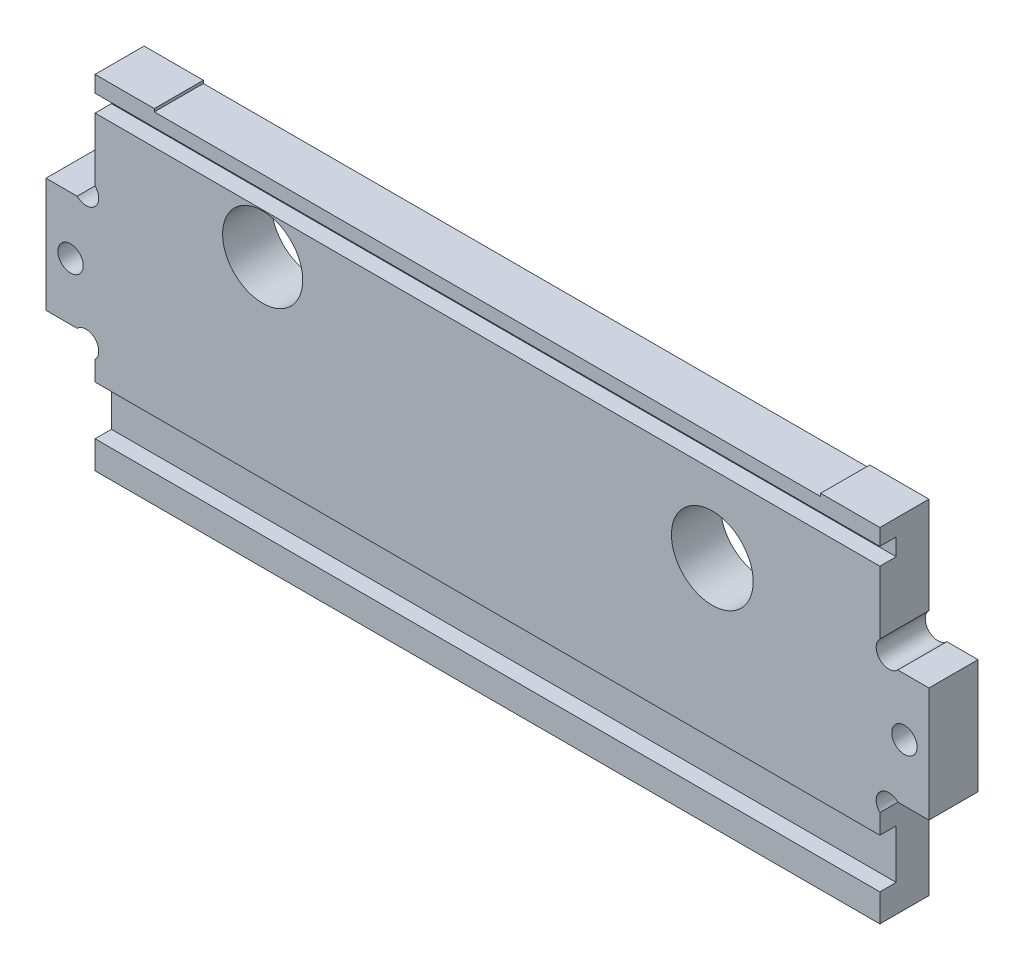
SolidWorks part; units mm, degrees
ref_plane "Plan de face" through (0, 0, 0) normal (0, 0, 1) x (1, 0, 0)
ref_plane "Plan de dessus" through (0, 0, 0) normal (0, 1, 0) x (1, 0, 0)
ref_plane "Plan de droite" through (0, 0, 0) normal (1, 0, 0) x (0, 0, -1)
sketch "Esquisse1" plane through (0, 0, 0) normal (0, 0, 1) x (1, 0, 0)
  line L0 (-18.4854, 0) -> (134.3664, 0) construction
  line L1 (0, -14.575) -> (0, 70.5052) construction
  line L2 (-18.4854, 42) -> (134.3664, 42) construction
  line L3 (-49.4967, 21) -> (232.5709, 21) construction
  line L4 (6, 65.2215) -> (6, -6.5783) construction
  line L5 (-6.1176, 9.4) -> (126.4146, 9.4) construction
  line L6 (-6.1176, 3.4) -> (126.4146, 3.4) construction
  line L7 (101.5, 56.6286) -> (101.5, -12.2812) construction
  line L8 (-7.2936, 37.9) -> (126.4146, 37.9) construction
  line L9 (-7.2936, 40) -> (126.4146, 40) construction
  line L10 (102, 56.6286) -> (102, -3.0419) construction
  line L11 (108, 70.5052) -> (108, -14.575) construction
  line L12 (54, 61.2759) -> (54, -18.1878) construction
  line L13 (6.2304, 24.4) -> (134.3664, 24.4) construction
  line L14 (6, 42) -> (13.25, 42)
  line L15 (6.5, 15.8677) -> (6.5, 70.5052) construction
  line L16 (-5.5754, 14) -> (7.661, 14) construction
  line L17 (6, 0) -> (102, 0)
  line L18 (6, 28) -> (-0.5822, 34.5822) construction
  line L19 (26.5, 37.2831) -> (26.5, 18.1829) construction
  line L20 (70.8365, 28.5) -> (98.2989, 28.5) construction
  line L21 (6, 42) -> (6, 30.192)
  line L22 (3.808, 28) -> (0, 28)
  line L23 (0, 28) -> (0, 14)
  line L24 (0, 14) -> (3.808, 14)
  line L25 (6, 11.808) -> (6, 0)
  line L26 (3, 24.9685) -> (3, 16.3645) construction
  line L27 (102, 11.808) -> (102, 0)
  line L28 (-9.5964, 28) -> (7.661, 28) construction
  line L29 (108, 14) -> (104.192, 14)
  line L30 (108, 28) -> (108, 14)
  line L31 (104.192, 28) -> (108, 28)
  line L32 (102, 42) -> (102, 30.192)
  line L33 (81.5, 37.2831) -> (81.5, 22.6035) construction
  line L34 (15.1811, 32.9) -> (39.9329, 32.9) construction
  line L35 (13.25, 54.7076) -> (13.25, 38.9745) construction
  line L36 (94.75, 54.7076) -> (94.75, 38.9745) construction
  line L37 (10.7716, 41.65) -> (104.192, 41.65) construction
  line L38 (13.25, 42) -> (13.25, 41.65)
  line L39 (13.25, 41.65) -> (94.75, 41.65)
  line L40 (94.75, 42) -> (94.75, 41.65)
  line L41 (-7.2936, 6.4) -> (126.4146, 6.4) construction
  line L42 (94.75, 42) -> (102, 42)
  circle A1 centre (81.5, 28.5) radius 5
  circle A2 centre (3, 21) radius 1.55
  arc A3 (3.808, 28) -> (6, 30.192) centre (4.904, 29.096) ccw
  arc A4 (3.808, 14) -> (6, 11.808) centre (4.904, 12.904) cw
  circle A5 centre (105, 21) radius 1.55
  arc A6 (104.192, 14) -> (102, 11.808) centre (103.096, 12.904) ccw
  arc A7 (104.192, 28) -> (102, 30.192) centre (103.096, 29.096) cw
  circle A8 centre (26.5, 32.9) radius 4.9
  dimension "D10" = 20
  dimension "D12" = 7
  dimension "D14" = 45
  dimension "D16" = 3
  dimension "D17" = 20
  dimension "D6" = 15
  dimension "D11" = 13.5
  dimension "D19" = 0.35
  dimension "D2" = 0.5
  dimension "D3" = 95
  dimension "D4" = 0.5
  dimension "D5" = 6
  dimension "D7" = 2
  dimension "D8" = 6
  dimension "D9" = 2.1
  dimension "D13" = 7
  dimension "D15" = 3
  dimension "D18" = 8.5
  dimension "D20" = 40.75
  dimension "D21" = 40.75
extrude "Extrusion1" add sketch "Esquisse1" along normal blind 6
sketch "Esquisse2" plane through (0, 0, 6) normal (0, 0, 1) x (1, 0, 0)
  line L0 (112.8828, 0) -> (-10.9966, 0) construction
  line L1 (-10.9966, 42) -> (112.8828, 42) construction
  line L2 (2.6841, 3.4) -> (105.6032, 3.4) construction
  line L3 (105.6032, 9.4) -> (2.6841, 9.4) construction
  line L4 (-3.7048, 40) -> (105.6032, 40) construction
  line L5 (105.6032, 37.9) -> (-3.7048, 37.9) construction
  line L7 (4.3484, 40) -> (104.0962, 40)
  line L8 (4.3484, 40) -> (4.3484, 37.9)
  line L9 (4.3484, 37.9) -> (104.0962, 37.9)
  line L10 (104.0962, 40) -> (104.0962, 37.9)
  line L11 (4.3484, 9.4) -> (103.3456, 9.4)
  line L12 (4.3484, 9.4) -> (4.3484, 3.4)
  line L13 (4.3484, 3.4) -> (103.3456, 3.4)
  line L14 (103.3456, 9.4) -> (103.3456, 3.4)
  dimension "D1" = 3.4
  dimension "D2" = 6
  dimension "D3" = 2
  dimension "D4" = 2.1
extrude "Enlèv. mat.-Extru.1" cut sketch "Esquisse2" against normal blind 2
